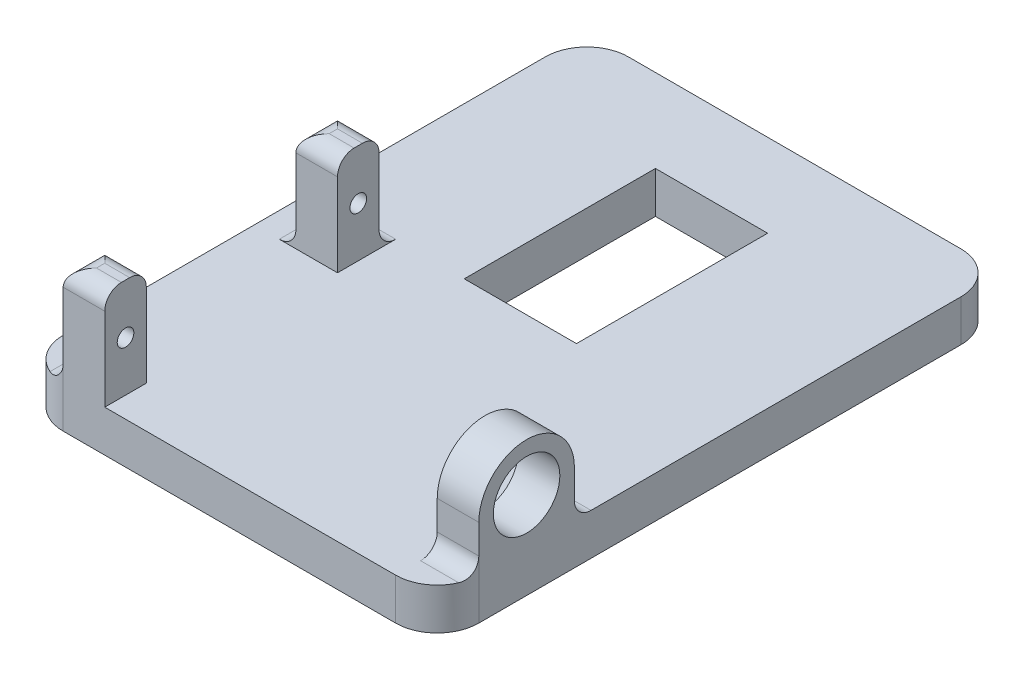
SolidWorks part; units mm, degrees
ref_plane "Front Plane" through (0, 0, 0) normal (0, 0, 1) x (1, 0, 0)
ref_plane "Top Plane" through (0, 0, 0) normal (0, 1, 0) x (1, 0, 0)
ref_plane "Right Plane" through (0, 0, 0) normal (1, 0, 0) x (0, 0, -1)
sketch "platform-sketch" plane through (0, 0, 0) normal (0, 1, 0) x (1, 0, 0)
  line L0 (0, 0) -> (0, 5.75) construction
  line L1 (-6.75, 17.25) -> (6.75, 17.25)
  line L2 (-6.75, 17.25) -> (-6.75, -5.75)
  line L3 (-6.75, -5.75) -> (6.75, -5.75)
  line L4 (6.75, 17.25) -> (6.75, -5.75)
  line L5 (-6.75, 17.25) -> (6.75, -5.75) construction
  line L6 (-6.75, -5.75) -> (6.75, 17.25) construction
  line L8 (-25, 27.25) -> (25, 27.25)
  line L9 (-25, 27.25) -> (-25, -40.75)
  line L10 (-25, -40.75) -> (25, -40.75)
  line L11 (25, 27.25) -> (25, -40.75)
  line L12 (-25, 27.25) -> (25, -40.75) construction
  line L13 (-25, -40.75) -> (25, 27.25) construction
  line L14 (0, 0) -> (0, -6.75) construction
  point P0 (0, 5.75)
  point P5 (0, 0)
  point P9 (0, -6.75)
  dimension "D1" = 13.5
  dimension "D2" = 23
  dimension "D3" = 5.75
  dimension "D4" = 35
  dimension "D6" = 10
  dimension "D7" = 50
extrude "platform-extrude" add sketch "platform-sketch" along normal blind 5
fillet "platform-fillet" radius 5 4 edges at (25, 2.5, 40.75) (-25, 2.5, 40.75) (25, 2.5, -27.25) (-25, 2.5, -27.25)
ref_plane "servo-mount-plane" through (-15, 0, 0) normal (-1, 0, 0) x (0, 0, 1)
sketch "servo-holder-sketch" plane through (-15, 0, 0) normal (-1, 0, 0) x (0, 0, 1)
  line L0 (-22.25, 5) -> (35.75, 5) construction
  line L1 (7.75, 17) -> (12.75, 17)
  line L2 (7.75, 17) -> (7.75, 5)
  line L3 (7.75, 5) -> (12.75, 5)
  line L4 (12.75, 17) -> (12.75, 5)
  line L5 (7.75, 17) -> (12.75, 5) construction
  line L6 (7.75, 5) -> (12.75, 17) construction
  line L7 (40.75, 5) -> (40.75, 0) construction
  line L8 (35.75, 17) -> (40.75, 17)
  line L9 (35.75, 17) -> (35.75, 5)
  line L10 (35.75, 5) -> (40.75, 5)
  line L11 (40.75, 17) -> (40.75, 5)
  line L12 (35.75, 17) -> (40.75, 5) construction
  line L13 (35.75, 5) -> (40.75, 17) construction
  circle A0 centre (10.25, 11) radius 1
  circle A1 centre (38.25, 11) radius 1
  point P0 (10.25, 11)
  point P7 (38.25, 11)
  dimension "D4" = 2
  dimension "D1" = 12
  dimension "D2" = 5
  dimension "D3" = 23
extrude "servo-holder" add sketch "servo-holder-sketch" along normal blind 5
fillet "servo-holder-fillet" radius 2 9 edges at (-20, 17, 38.25) (-20, 17, 10.25) (-17.5, 5, 7.75) (-20, 5, 10.25) (-20, 5, 38.25) (-17.5, 17, 40.75) (-17.5, 17, 35.75) (-17.5, 17, 12.75) (-17.5, 17, 7.75)
sketch "pin-holder-sketch" plane through (25, 0, 0) normal (1, 0, 0) x (0, 0, -1)
  line L0 (-35.75, 5) -> (-35.75, 10.5)
  line L1 (-35.75, 5) -> (22.25, 5) construction
  line L2 (-24.25, 5) -> (-24.25, 10.5)
  line L3 (-35.75, 5) -> (-24.25, 5)
  line L4 (-40.75, 0) -> (-40.75, 5) construction
  circle A0 centre (-30, 10.5) radius 4
  arc A1 (-35.75, 10.5) -> (-24.25, 10.5) centre (-30, 10.5) cw
  point P10 (-30, 10.5)
  dimension "D1" = 8
  dimension "D2" = 5.75
  dimension "D3" = 5.5
  dimension "D4" = 5
extrude "pin-holder" add sketch "pin-holder-sketch" against normal blind 5
fillet "pin-holder-fillet" radius 2 2 edges at (22.5, 5, 35.75) (22.5, 5, 24.25)
